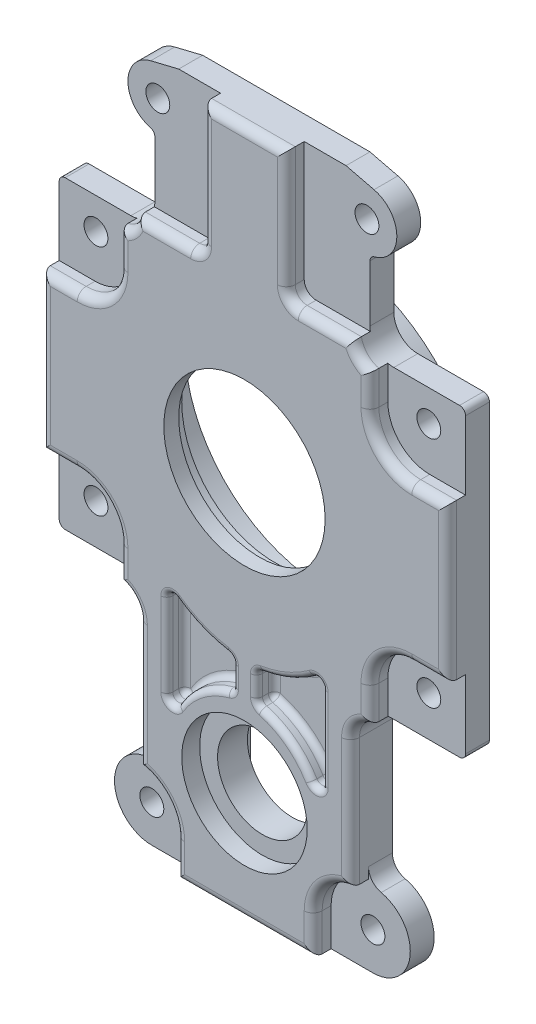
SolidWorks part; units mm, degrees
ref_plane "Plan1" through (0, 0, 0) normal (0, 0, 1) x (1, 0, 0)
ref_plane "Plan2" through (0, 0, 0) normal (0, 1, 0) x (1, 0, 0)
ref_plane "Plan3" through (0, 0, 0) normal (1, 0, 0) x (0, 0, -1)
sketch "Esquisse1" plane through (0, 0, 0) normal (0, 0, 1) x (1, 0, 0)
  line L1 (18, 92.75) -> (18, 102.1905)
  line L2 (-18, 92.75) -> (-18, 102.1905)
  line L3 (18.6846, 112.8577) -> (14, 114)
  line L4 (-18.6846, 112.8577) -> (-14, 114)
  line L5 (-22, 88.75) -> (-33, 88.75)
  line L6 (22, 88.75) -> (33, 88.75)
  line L7 (-30.5, 37.75) -> (-21.75, 37.75)
  line L8 (21.75, 37.75) -> (30.5, 37.75)
  line L36 (17.75, 14.275) -> (17.75, 33.75)
  line L38 (30.5, 37.75) -> (33, 37.75)
  line L39 (34, 87.75) -> (34, 38.75)
  line L41 (0, 112.8139) -> (0, 21.3847) construction
  line L43 (-34, 87.75) -> (-34, 38.75)
  line L44 (-33, 37.75) -> (-30.5, 37.75)
  line L46 (-17.75, 33.75) -> (-17.75, 14.275)
  line L47 (-18.5, -0.75) -> (18.5, -0.75)
  line L54 (14, 114) -> (0, 114)
  line L55 (-14, 114) -> (0, 114)
  arc A0 (18.75, 103.1588) -> (18.6846, 112.8577) centre (17.5, 108) ccw
  arc A1 (-18.75, 103.1588) -> (-18.6846, 112.8577) centre (-17.5, 108) cw
  circle A5 centre (-18.5, 5.5) radius 2
  circle A8 centre (-27.8512, 44.4984) radius 2
  circle A9 centre (27.8512, 44.4984) radius 2
  circle A10 centre (18.5, 5.5) radius 2
  circle A14 centre (17.5, 108) radius 2
  circle A15 centre (-17.5, 108) radius 2
  circle A16 centre (-27.8512, 83.5016) radius 2
  circle A17 centre (27.8512, 83.5016) radius 2
  arc A18 (21.75, 37.75) -> (17.75, 33.75) centre (21.75, 33.75) ccw
  arc A19 (-21.75, 37.75) -> (-17.75, 33.75) centre (-21.75, 33.75) cw
  arc A30 (17.75, 14.275) -> (19.8889, 11.5937) centre (20.5, 14.275) ccw
  arc A31 (-18, 92.75) -> (-22, 88.75) centre (-22, 92.75) cw
  arc A32 (22, 88.75) -> (18, 92.75) centre (22, 92.75) cw
  arc A33 (34, 87.75) -> (33, 88.75) centre (33, 87.75) ccw
  arc A34 (34, 38.75) -> (33, 37.75) centre (33, 38.75) cw
  arc A35 (-34, 38.75) -> (-33, 37.75) centre (-33, 38.75) ccw
  arc A37 (-19.8889, 11.5937) -> (-17.75, 14.275) centre (-20.5, 14.275) ccw
  arc A38 (-19.8889, 11.5937) -> (-18.5, -0.75) centre (-18.5, 5.5) ccw
  arc A39 (18.5, -0.75) -> (19.8889, 11.5937) centre (18.5, 5.5) ccw
  arc A40 (-34, 87.75) -> (-33, 88.75) centre (-33, 87.75) cw
  arc A41 (18.75, 103.1588) -> (18, 102.1905) centre (19, 102.1905) ccw
  arc A42 (-18.75, 103.1588) -> (-18, 102.1905) centre (-19, 102.1905) cw
  point P94 (18, 103.0251)
  point P97 (-18, 103.0251)
  dimension "D4" = 36
  dimension "D3" = 5
  dimension "D7" = 51
  dimension "D8" = 1
  dimension "D9" = 4
  dimension "D1" = 4
  dimension "D2" = 68
  dimension "D5" = 28
extrude "Base-Extrusion" add sketch "Esquisse1" along normal blind 3
sketch "Esquisse2" plane through (0, 0, 3) normal (0, 0, 1) x (1, 0, 0)
  line L0 (0, 127) -> (0, -6) construction
  line L1 (-39, 63.25) -> (45, 63.25) construction
  line L2 (33, 88.75) -> (22, 88.75) construction
  line L3 (21.75, 37.75) -> (33, 37.75) construction
  line L4 (7, 114) -> (-7, 114)
  line L5 (21, 43.25) -> (21, 37.6791)
  line L6 (14, 114) -> (-14, 114) construction
  line L7 (-7, 114) -> (-7, 94)
  line L8 (7, 114) -> (7, 94)
  line L9 (-9, 92) -> (-18.0709, 92)
  line L10 (9, 92) -> (18.0709, 92)
  line L11 (-21, 88.877) -> (-21, 83.25)
  line L12 (17.75, 14.5539) -> (17.75, 12.4597)
  line L13 (21, 88.877) -> (21, 83.25)
  line L14 (-21, 43.25) -> (-21, 37.6791)
  line L15 (11.5, -0.75) -> (11.5, 5.5)
  line L16 (-28, 76.25) -> (-34, 76.25)
  line L17 (-34, 87.75) -> (-34, 38.75) construction
  line L18 (28, 76.25) -> (34, 76.25)
  line L19 (-34, 50.25) -> (-28, 50.25)
  line L20 (34, 50.25) -> (28, 50.25)
  line L21 (-11.5, -0.75) -> (-11.5, 5.5)
  line L22 (-13, 39.1509) -> (-13, 25.2128)
  line L23 (13, 39.1509) -> (13, 25.2128)
  line L24 (-18.5, -0.75) -> (18.5, -0.75) construction
  line L25 (-2, 35.3821) -> (-2, 32.038)
  line L26 (2, 35.3821) -> (2, 32.038)
  line L27 (-9, 17.553) -> (8.141, 17.553) construction
  line L28 (-11.5, -0.75) -> (11.5, -0.75)
  line L29 (-17.75, 33.75) -> (-17.75, 14.275) construction
  line L30 (-17.75, 33.75) -> (-17.75, 12.4597)
  line L31 (17.75, 14.275) -> (17.75, 33.75) construction
  line L32 (17.75, 14.5539) -> (17.75, 33.75)
  line L33 (34, 38.75) -> (34, 87.75) construction
  line L34 (-34, 76.25) -> (-34, 50.25)
  line L35 (34, 50.25) -> (34, 76.25)
  arc A0 (-22, 88.75) -> (-18, 92.75) centre (-22, 92.75) ccw construction
  arc A1 (-17.75, 33.75) -> (-21.75, 37.75) centre (-21.75, 33.75) ccw construction
  arc A2 (-17.75, 33.75) -> (-21, 37.6791) centre (-21.75, 33.75) ccw
  arc A3 (21.75, 37.75) -> (17.75, 33.75) centre (21.75, 33.75) ccw construction
  arc A4 (21, 37.6791) -> (17.75, 33.75) centre (21.75, 33.75) ccw
  arc A6 (18.0709, 92) -> (21, 88.877) centre (22, 92.75) ccw
  arc A7 (-18.0709, 92) -> (-21, 88.877) centre (-22, 92.75) cw
  arc A8 (28, 50.25) -> (21, 43.25) centre (28, 43.25) ccw
  arc A9 (-28, 50.25) -> (-21, 43.25) centre (-28, 43.25) cw
  arc A10 (-28, 76.25) -> (-21, 83.25) centre (-28, 83.25) ccw
  arc A11 (28, 76.25) -> (21, 83.25) centre (28, 83.25) cw
  arc A12 (-11.41, 39.9583) -> (-2.8386, 36.369) centre (0.3894, 56.1068) ccw
  arc A13 (17.75, 12.4597) -> (11.5, 5.5) centre (18.5, 5.5) ccw
  arc A14 (-17.75, 12.4597) -> (-11.5, 5.5) centre (-18.5, 5.5) cw
  arc A15 (11.41, 39.9583) -> (2.8386, 36.369) centre (-0.3894, 56.1068) cw
  circle A16 centre (-18.5, 5.5) radius 2 construction
  arc A17 (-2.7402, 31.0723) -> (-11.1402, 24.7022) centre (0.8968, 17.553) ccw
  arc A18 (2.7402, 31.0723) -> (11.1402, 24.7022) centre (-0.8968, 17.553) cw
  arc A19 (-11.1402, 24.7022) -> (-13, 25.2128) centre (-12, 25.2128) cw
  arc A20 (-11.41, 39.9583) -> (-13, 39.1509) centre (-12, 39.1509) ccw
  arc A21 (-2.8386, 36.369) -> (-2, 35.3821) centre (-3, 35.3821) cw
  arc A22 (-2.7402, 31.0723) -> (-2, 32.038) centre (-3, 32.038) ccw
  arc A23 (2.7402, 31.0723) -> (2, 32.038) centre (3, 32.038) cw
  arc A24 (2.8386, 36.369) -> (2, 35.3821) centre (3, 35.3821) ccw
  arc A25 (11.41, 39.9583) -> (13, 39.1509) centre (12, 39.1509) cw
  arc A26 (11.1402, 24.7022) -> (13, 25.2128) centre (12, 25.2128) ccw
  arc A27 (-9, 92) -> (-7, 94) centre (-9, 94) ccw
  arc A28 (9, 92) -> (7, 94) centre (9, 94) cw
  circle A29 centre (0, 17.553) radius 10.5
  point P15 (0, 114)
  point P39 (21, 50.25)
  point P51 (0, -0.75)
  point P62 (-21, 50.25)
  point P65 (-21, 76.25)
  point P68 (21, 76.25)
  point P89 (-13, 19.25)
  point P92 (-13, 41.25)
  point P95 (-2, 36.25)
  point P98 (-2, 31.25)
  point P101 (2, 31.25)
  point P104 (2, 36.25)
  point P107 (13, 41.25)
  point P110 (13, 19.25)
  point P113 (-7, 92)
  point P116 (7, 92)
  dimension "D6" = 7
  dimension "D7" = 26
  dimension "D8" = 4
  dimension "D2" = 7
  dimension "D9" = 20
  dimension "D10" = 14
  dimension "D15" = 1
  dimension "D16" = 2
  dimension "D17" = 21
  dimension "D1" = 14
  dimension "D3" = 42
  dimension "D4" = 26
  dimension "D5" = 22
  dimension "D11" = 42
  dimension "D12" = 37
  dimension "D13" = 22
  dimension "D14" = 5
extrude "Boss.-Extru.1" add sketch "Esquisse2" along normal blind 3
fillet "Congé1" radius 1.5
fillet "Congé2" radius 1
sketch "Esquisse6" plane through (0, 0, 0) normal (0, 0, -1) x (-1, 0, 0)
  line L0 (-43, 64) -> (50, 64) construction
  line L1 (0, 117) -> (0, 11) construction
  line L4 (-14, 114) -> (14, 114) construction
  circle A0 centre (0, 64) radius 26.25
  dimension "D1" = 52.5
  dimension "D2" = 50
extrude "Boss.-Extru.2" add sketch "Esquisse6" along normal blind 7.5
sketch "Esquisse8" plane through (0, 0, 0) normal (1, 0, 0) x (0, 0, -1)
  line L3 (7.5, 40.5) -> (-0.5, 40.5)
  line L4 (7.5, 37.75) -> (7.5, 90.25) construction
  line L5 (-0.5, 40.5) -> (-0.5, 44.5)
  line L6 (-0.5, 44.5) -> (-1, 44.5)
  line L7 (-1, 44.5) -> (-1, 48.5)
  line L8 (-1, 48.5) -> (-3.5, 48.5)
  line L9 (-3.5, 48.5) -> (-3.5, 50.5)
  line L10 (-3.5, 50.5) -> (-6, 50.5)
  line L11 (-6, 50.5) -> (-6, 64)
  line L12 (-6, 64) -> (7.5, 64)
  line L13 (7.5, 64) -> (7.5, 40.5)
  line L14 (-6, 51.75) -> (-6, 74.75) construction
  line L15 (-8, 64) -> (10, 64) construction
  line L16 (-4.5, 76.25) -> (-3, 76.25) construction
  line L17 (-4.5, 76.25) -> (-3, 76.25) construction
  dimension "D1" = 8
  dimension "D2" = 12.25
  dimension "D3" = 47
  dimension "D4" = 13.5
  dimension "D5" = 31
  dimension "D6" = 2.5
  dimension "D7" = 2.5
  dimension "D8" = 39
revolve "Enlèvement de matière-Révolution1" cut sketch "Esquisse8" angle 360 about L15
sketch "Esquisse9" plane through (0, 0, 0) normal (0, 0, -1) x (-1, 0, 0)
  line L0 (0, 64) -> (0, -5) construction
  line L1 (-12, 40.6534) -> (-12, 9.25)
  line L2 (12, 40.6534) -> (12, 9.25)
  line L3 (-5, 2.25) -> (5, 2.25)
  line L4 (18.5, -0.75) -> (-18.5, -0.75) construction
  circle A0 centre (0, 64) radius 26.25 construction
  arc A1 (-12, 40.6534) -> (12, 40.6534) centre (0, 64) ccw
  arc A2 (-5, 2.25) -> (-12, 9.25) centre (-5, 9.25) cw
  arc A3 (5, 2.25) -> (12, 9.25) centre (5, 9.25) ccw
  point P10 (0, 2.25)
  point P14 (-12, 2.25)
  point P17 (12, 2.25)
  dimension "D3" = 7
  dimension "D1" = 24
  dimension "D2" = 3
extrude "Boss.-Extru.3" add sketch "Esquisse9" along normal blind 2
sketch "Esquisse10" plane through (0, 0, -2) normal (0, 0, -1) x (-1, 0, 0)
  line L2 (0, 51) -> (0, 6) construction
  line L3 (-12, 40.6534) -> (-12, 9.25) construction
  line L4 (-12, 11.25) -> (-10, 11.25)
  line L5 (-12, 11.25) -> (-12, 29.25)
  line L6 (-12, 29.25) -> (-10, 29.25)
  line L7 (-10, 11.25) -> (-10, 29.25)
  line L8 (10, 11.25) -> (10, 29.25)
  line L9 (12, 29.25) -> (10, 29.25)
  line L10 (12, 11.25) -> (12, 29.25)
  line L11 (12, 11.25) -> (10, 11.25)
  line L12 (-5, 2.25) -> (5, 2.25) construction
  dimension "D1" = 9
  dimension "D2" = 18
  dimension "D3" = 2
extrude "Boss.-Extru.4" add sketch "Esquisse10" along normal blind 3
hole_wizard "Perçage1" positions "Esquisse4" profile "Esquisse3" tap size "M16x2.0" standard "ISO"
sketch "Esquisse4" plane through (0, 0, 3) normal (0, 0, 1) x (1, 0, 0)
  circle A0 centre (0, 17.553) radius 10.5 construction
  point P0 (0, 17.553)
sketch "Esquisse3" plane through (0, 17.553, 3) normal (1, 0, 0) x (0, -1, 0)
  line L0 (0, 0) -> (0, 10.5)
  line L1 (0, 10.5) -> (7, 10.5)
  line L3 (7, 10.5) -> (7, 32)
  line L4 (7, 32) -> (7.5, 32)
  line L5 (7.5, 32) -> (7.5, 0)
  line L7 (7.5, 0) -> (0, 0)
  line L11 (0, -6.35) -> (0, 107.95) construction
  dimension "Diamètre du trou pour taraudage jusqu'au prochain" = 14
  dimension "Profondeur du trou pour taraudage jusqu'au prochain" = 10.5
  dimension "Diamètre du filetage" = 15
  dimension "Profondeur du filetage" = 32
fillet "Congé3" radius 1
sketch "Esquisse11" plane through (0, 0, 0) normal (0, 0, -1) x (-1, 0, 0)
  line L0 (-12, 40.6534) -> (-12, 9.25) construction
  line L1 (-5, 2.25) -> (5, 2.25) construction
  line L2 (12, 9.25) -> (12, 40.6534) construction
  line L3 (-12, 40.6534) -> (-12, 9.25)
  line L4 (-5, 2.25) -> (5, 2.25)
  line L5 (12, 9.25) -> (12, 40.6534)
  line L14 (-18, 102.1905) -> (-18, 92.75)
  line L15 (-22, 88.75) -> (-33, 88.75)
  line L16 (-34, 87.75) -> (-34, 38.75)
  line L17 (-33, 37.75) -> (-21.75, 37.75)
  line L18 (-17.75, 33.75) -> (-17.75, 14.275)
  line L19 (-18.5, -0.75) -> (18.5, -0.75)
  line L20 (17.75, 14.275) -> (17.75, 33.75)
  line L21 (21.75, 37.75) -> (33, 37.75)
  line L22 (34, 38.75) -> (34, 87.75)
  line L23 (33, 88.75) -> (22, 88.75)
  line L24 (18, 92.75) -> (18, 102.1905)
  line L25 (18.6846, 112.8577) -> (14, 114)
  line L26 (14, 114) -> (-14, 114)
  line L27 (-14, 114) -> (-18.6846, 112.8577)
  line L28 (-18, 102.1905) -> (-18, 92.75)
  line L29 (-22, 88.75) -> (-33, 88.75)
  line L30 (-34, 87.75) -> (-34, 38.75)
  line L31 (-33, 37.75) -> (-21.75, 37.75)
  line L32 (-17.75, 33.75) -> (-17.75, 14.275)
  line L33 (-18.5, -0.75) -> (18.5, -0.75)
  line L34 (17.75, 14.275) -> (17.75, 33.75)
  line L35 (21.75, 37.75) -> (33, 37.75)
  line L36 (34, 38.75) -> (34, 87.75)
  line L37 (33, 88.75) -> (22, 88.75)
  line L38 (18, 92.75) -> (18, 102.1905)
  line L39 (18.6846, 112.8577) -> (14, 114)
  line L40 (14, 114) -> (-14, 114)
  line L41 (-14, 114) -> (-18.6846, 112.8577)
  arc A0 (-12, 9.25) -> (-5, 2.25) centre (-5, 9.25) ccw construction
  arc A1 (5, 2.25) -> (12, 9.25) centre (5, 9.25) ccw construction
  arc A2 (12, 40.6534) -> (-12, 40.6534) centre (0, 64) ccw construction
  arc A3 (-12, 9.25) -> (-5, 2.25) centre (-5, 9.25) ccw
  arc A4 (5, 2.25) -> (12, 9.25) centre (5, 9.25) ccw
  arc A5 (12, 40.6534) -> (-12, 40.6534) centre (0, 64) ccw
  arc A16 (-18.6846, 112.8577) -> (-18.75, 103.1588) centre (-17.5, 108) ccw
  arc A17 (-18, 102.1905) -> (-18.75, 103.1588) centre (-19, 102.1905) ccw
  arc A18 (-22, 88.75) -> (-18, 92.75) centre (-22, 92.75) ccw
  arc A19 (-33, 88.75) -> (-34, 87.75) centre (-33, 87.75) ccw
  arc A20 (-34, 38.75) -> (-33, 37.75) centre (-33, 38.75) ccw
  arc A21 (-17.75, 33.75) -> (-21.75, 37.75) centre (-21.75, 33.75) ccw
  arc A22 (-19.8889, 11.5937) -> (-17.75, 14.275) centre (-20.5, 14.275) ccw
  arc A23 (-19.8889, 11.5937) -> (-18.5, -0.75) centre (-18.5, 5.5) ccw
  arc A24 (18.5, -0.75) -> (19.8889, 11.5937) centre (18.5, 5.5) ccw
  arc A25 (17.75, 14.275) -> (19.8889, 11.5937) centre (20.5, 14.275) ccw
  arc A26 (21.75, 37.75) -> (17.75, 33.75) centre (21.75, 33.75) ccw
  arc A27 (33, 37.75) -> (34, 38.75) centre (33, 38.75) ccw
  arc A28 (34, 87.75) -> (33, 88.75) centre (33, 87.75) ccw
  arc A29 (18, 92.75) -> (22, 88.75) centre (22, 92.75) ccw
  arc A30 (18.75, 103.1588) -> (18, 102.1905) centre (19, 102.1905) ccw
  arc A31 (18.75, 103.1588) -> (18.6846, 112.8577) centre (17.5, 108) ccw
  arc A32 (-18.6846, 112.8577) -> (-18.75, 103.1588) centre (-17.5, 108) ccw
  arc A33 (-18, 102.1905) -> (-18.75, 103.1588) centre (-19, 102.1905) ccw
  arc A34 (-22, 88.75) -> (-18, 92.75) centre (-22, 92.75) ccw
  arc A35 (-33, 88.75) -> (-34, 87.75) centre (-33, 87.75) ccw
  arc A36 (-34, 38.75) -> (-33, 37.75) centre (-33, 38.75) ccw
  arc A37 (-17.75, 33.75) -> (-21.75, 37.75) centre (-21.75, 33.75) ccw
  arc A38 (-19.8889, 11.5937) -> (-17.75, 14.275) centre (-20.5, 14.275) ccw
  arc A39 (-19.8889, 11.5937) -> (-18.5, -0.75) centre (-18.5, 5.5) ccw
  arc A40 (18.5, -0.75) -> (19.8889, 11.5937) centre (18.5, 5.5) ccw
  arc A41 (17.75, 14.275) -> (19.8889, 11.5937) centre (20.5, 14.275) ccw
  arc A42 (21.75, 37.75) -> (17.75, 33.75) centre (21.75, 33.75) ccw
  arc A43 (33, 37.75) -> (34, 38.75) centre (33, 38.75) ccw
  arc A44 (34, 87.75) -> (33, 88.75) centre (33, 87.75) ccw
  arc A45 (18, 92.75) -> (22, 88.75) centre (22, 92.75) ccw
  arc A46 (18.75, 103.1588) -> (18, 102.1905) centre (19, 102.1905) ccw
  arc A47 (18.75, 103.1588) -> (18.6846, 112.8577) centre (17.5, 108) ccw
  dimension "D1" = 0
extrude "Boss.-Extru.5" add sketch "Esquisse11" along normal blind 1
sketch "Esquisse12" plane through (0, 0, 3) normal (0, 0, 1) x (1, 0, 0)
  circle A0 centre (18.5, 5.5) radius 2 construction
  circle A1 centre (-18.5, 5.5) radius 2 construction
  circle A2 centre (-27.8512, 44.4984) radius 2 construction
  circle A3 centre (27.8512, 44.4984) radius 2 construction
  circle A4 centre (-27.8512, 83.5016) radius 2 construction
  circle A5 centre (27.8512, 83.5016) radius 2 construction
  circle A6 centre (17.5, 108) radius 2 construction
  circle A7 centre (-17.5, 108) radius 2 construction
  circle A8 centre (18.5, 5.5) radius 2
  circle A9 centre (-18.5, 5.5) radius 2
  circle A10 centre (-27.8512, 44.4984) radius 2
  circle A11 centre (27.8512, 44.4984) radius 2
  circle A12 centre (-27.8512, 83.5016) radius 2
  circle A13 centre (27.8512, 83.5016) radius 2
  circle A14 centre (17.5, 108) radius 2
  circle A15 centre (-17.5, 108) radius 2
extrude "Enlèv. mat.-Extru.1" cut sketch "Esquisse12" against normal through all
